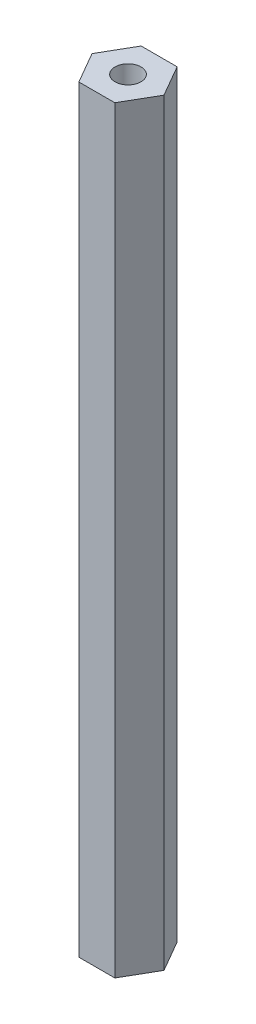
SolidWorks part; units mm, degrees
ref_plane "Plano frontal" through (0, 0, 0) normal (0, 0, 1) x (1, 0, 0)
ref_plane "Plano superior" through (0, 0, 0) normal (0, 1, 0) x (1, 0, 0)
ref_plane "Plano direito" through (0, 0, 0) normal (1, 0, 0) x (0, 0, -1)
sketch "Esboço1" plane through (0, 0, 0) normal (0, 1, 0) x (1, 0, 0)
  line L1 (3.4641, 0) -> (1.7321, 3)
  line L2 (1.7321, 3) -> (-1.7321, 3)
  line L3 (-1.7321, 3) -> (-3.4641, 0)
  line L4 (-3.4641, 0) -> (-1.7321, -3)
  line L5 (-1.7321, -3) -> (1.7321, -3)
  line L6 (1.7321, -3) -> (3.4641, 0)
  circle A1 centre (0, 0) radius 3 construction
  dimension "D1" = 6
extrude "Ressalto-extrusão1" add sketch "Esboço1" along normal blind 73
sketch "Esboço7" plane through (0, 0, 0) normal (0, -1, 0) x (1, 0, 0)
  point P0 (0, 0)
hole_wizard "Furo roscado de M3x0.52" positions "3DSketch4" profile "Esboço8" tap size "M3x0.5" standard "Ansi Metric"
sketch3d "3DSketch4"
  point P0 (0, 0, 0)
  point P3 (0, 0, 0)
  point P6 (0, 0, 0)
  point P8 (0, 0, 0)
  point P10 (0, 0, 0)
sketch "Esboço8" plane through (0, 0, 0) normal (1, 0, 0) x (0, 0, -1)
  line L0 (0, 0) -> (0, 12.7511)
  line L1 (0, 12.7511) -> (1.25, 12)
  line L2 (1.25, 12) -> (1.25, 0)
  line L5 (1.25, 0) -> (0, 0)
  line L10 (0, 12.7511) -> (-1.25, 12) construction
  line L11 (0, -6.35) -> (0, 107.95) construction
  dimension "Tap Drill Dia." = 2.5
  dimension "Tap Drill Depth" = 12
  dimension "Drill Angle" = 118
ref_plane "Plano1" through (0, 36.5, 0) normal (0, -1, 0) x (-1, 0, 0)
mirror "Espelhar1" about plane through (0, 36.5, 0) normal (0, -1, 0) of "Furo roscado de M3x0.52"
